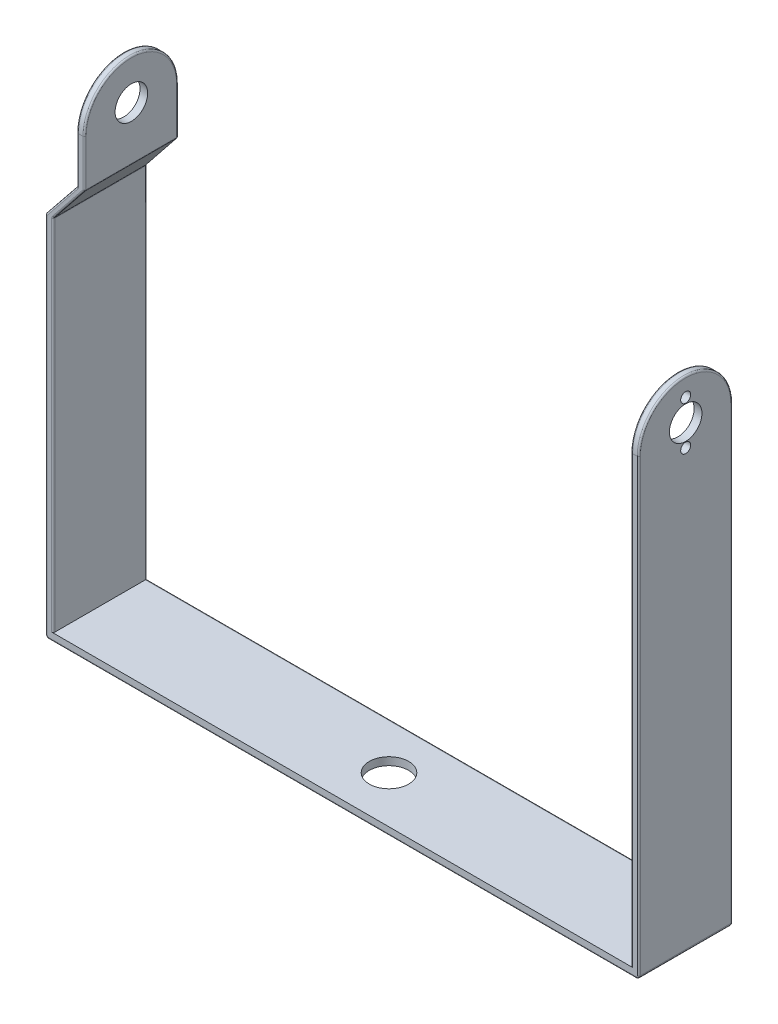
SolidWorks part; units mm, degrees
ref_plane "Plan de face" through (0, 0, 0) normal (0, 0, 1) x (1, 0, 0)
ref_plane "Plan de dessus" through (0, 0, 0) normal (0, 1, 0) x (1, 0, 0)
ref_plane "Plan de droite" through (0, 0, 0) normal (1, 0, 0) x (0, 0, -1)
sketch "Esquisse1" plane through (0, 0, 0) normal (0, 0, 1) x (1, 0, 0)
  line L0 (-177.5, 160) -> (-177.5, 2.5)
  line L1 (-190, 160) -> (0, 160)
  line L2 (-190, 160) -> (-190, 0)
  line L3 (-190, 0) -> (0, 0)
  line L4 (0, 160) -> (0, 0)
  line L5 (-177.5, 2.5) -> (-2.5, 2.5)
  line L6 (-2.5, 2.5) -> (-2.5, 160)
  line L7 (-190, 160) -> (-177.5, 160)
  line L8 (-2.5, 160) -> (0, 160)
  dimension "D1" = 190
  dimension "D2" = 160
  dimension "D3" = 12.5
  dimension "D4" = 2.5
  dimension "D5" = 2.5
extrude "Extrusion1" add sketch "Esquisse1" along normal blind 30 contours L6 L5 L0 L1 L2 L3 L4
fillet "Congé1" radius 1 2 edges at (0, 0, 15) (-190, 0, 15)
sketch "Esquisse2" plane through (0, 0, 30) normal (0, 0, 1) x (1, 0, 0)
  line L1 (-177.5, 2.5) -> (-187.5, 2.5)
  line L2 (-177.5, 2.5) -> (-177.5, 117.5)
  line L3 (-177.5, 117.5) -> (-187.5, 117.5)
  line L4 (-187.5, 2.5) -> (-187.5, 117.5)
  dimension "D1" = 10
  dimension "D2" = 115
extrude "Enlèv. mat.-Extru.1" cut sketch "Esquisse2" against normal blind 30
sketch "Esquisse3" plane through (0, 0, 30) normal (0, 0, 1) x (1, 0, 0)
  line L0 (-187.5, 117.5) -> (-177.5, 130)
  line L1 (-177.5, 160) -> (-177.5, 117.5) construction
  line L2 (-187.5, 117.5) -> (-204.2108, 117.5) construction
  line L3 (-190, 123.227) -> (-190, 112.8776) construction
  line L4 (-190, 160) -> (-190, 1) construction
  line L5 (-190, 117.5) -> (-179.9384, 130)
  line L6 (-179.9384, 130) -> (-179.9384, 160)
  line L7 (-190, 160) -> (-177.5, 160) construction
  line L8 (-177.5, 130) -> (-177.5, 160)
  line L9 (-177.5, 160) -> (-179.9384, 160)
  line L10 (-177.5, 130) -> (-177.5, 117.5)
  line L11 (-177.5, 117.5) -> (-187.5, 117.5)
  line L12 (-190, 117.5) -> (-190, 160)
  line L13 (-190, 160) -> (-179.9384, 160)
  line L14 (-179.9384, 160) -> (-190, 160)
  point P11 (-190, 117.5)
  dimension "D1" = 30
  dimension "D2" = 30
  dimension "D3" = 2.4384
extrude "Enlèv. mat.-Extru.2" cut sketch "Esquisse3" against normal blind 30 contours L5 L6 M5 M6 | L0 M3 M4
sketch "Esquisse4" plane through (0, 0, 0) normal (1, 0, 0) x (0, 0, -1)
  line L0 (-30, 147.1) -> (0, 147.1) construction
  line L1 (-30, 160) -> (-30, 1) construction
  line L2 (0, 160) -> (0, 1) construction
  line L3 (-15, 160) -> (-15, 127.2293) construction
  line L4 (-30, 160) -> (0, 160) construction
  circle A0 centre (-15, 147.1) radius 5.21
  dimension "D1" = 10.42
  dimension "D2" = 12.9
  dimension "D3" = 12.9
extrude "Enlèv. mat.-Extru.3" cut sketch "Esquisse4" against normal through all
sketch "Esquisse5" plane through (0, 0, 0) normal (1, 0, 0) x (0, 0, -1)
  line L0 (-30, 145) -> (0, 145) construction
  line L1 (-30, 160) -> (-30, 1) construction
  line L2 (0, 160) -> (0, 1) construction
  line L3 (-30, 160) -> (0, 160) construction
  line L4 (-15, 160) -> (-15, 121.0998) construction
  line L6 (-30, 145) -> (0, 145)
  line L7 (-30, 145) -> (-30, 160)
  line L8 (-30, 160) -> (0, 160)
  line L9 (0, 145) -> (0, 160)
  arc A0 (0, 145) -> (-30, 145) centre (-15, 145) ccw
  point P10 (-15, 145)
  dimension "D1" = 15
extrude "Enlèv. mat.-Extru.4" cut sketch "Esquisse5" against normal through all contours A0 M6 M3 | A0 L8 M5
fillet "Congé3" radius 0.5 31 edges at (0, 73, 0) (-95, 2.5, 0) (-177.5, 137.5, 0) (-2.5, 73.75, 0) (-95, 0, 0) (-95, 0, 30) (-0.2929, 0.2929, 0) (-189.7071, 0.2929, 0) (-0.2929, 0.2929, 30) (-189.7071, 0.2929, 30) (-187.5, 60, 0) (-187.5, 117.5, 15) (-187.5, 60, 30) (-2.5, 73.75, 30) (-190, 59.25, 0) (-190, 59.25, 30) (-184.9692, 123.75, 0) (-179.9384, 130, 15) (-190, 117.5, 15) (-179.9384, 137.5, 0) (-184.9692, 123.75, 30) (-179.9384, 137.5, 30) (-182.5, 123.75, 30) (-177.5, 130, 15) (-182.5, 123.75, 0) (-179.9384, 160, 15) (0, 73, 30) (-177.5, 137.5, 30) (-177.5, 160, 15) (-2.5, 160, 15) (0, 160, 15)
sketch "Esquisse6" plane through (0, 0, 0) normal (0, -1, 0) x (1, 0, 0)
  line L0 (-1, 15) -> (-189, 15) construction
  line L1 (-1, 0.5) -> (-1, 29.5) construction
  line L2 (-189, 29.5) -> (-189, 0.5) construction
  line L3 (-95, 0.5) -> (-95, 29.5) construction
  line L4 (-189, 0.5) -> (-1, 0.5) construction
  line L5 (-1, 29.5) -> (-189, 29.5) construction
  circle A0 centre (-95, 15) radius 6.3
  dimension "D1" = 12.6
extrude "Enlèv. mat.-Extru.5" cut sketch "Esquisse6" against normal through all
sketch "Esquisse7" plane through (0, 0, 0) normal (1, 0, 0) x (0, 0, -1)
  line L0 (-15, 152.31) -> (-15, 141.89) construction
  line L1 (-9.79, 147.1) -> (-20.21, 147.1) construction
  line L2 (-15, 147.1) -> (-15, 140.1) construction
  circle A0 centre (-15, 147.1) radius 5.21 construction
  circle A1 centre (-15, 140.1) radius 1.6
  circle A2 centre (-15, 154.1) radius 1.6
  dimension "D2" = 3.2
  dimension "D1" = 7
  dimension "D3" = 1.79
extrude "Enlèv. mat.-Extru.6" cut sketch "Esquisse7" against normal blind 10
